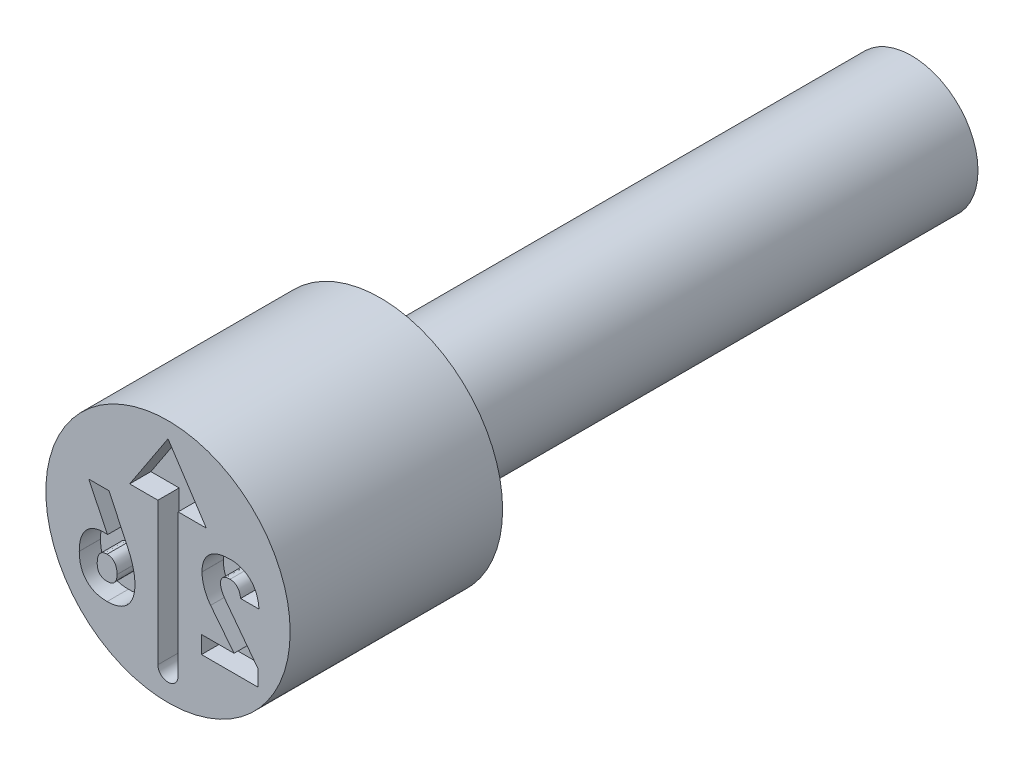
SolidWorks part; units mm, degrees
ref_plane "Front Plane" through (0, 0, 0) normal (0, 0, 1) x (1, 0, 0)
ref_plane "Top Plane" through (0, 0, 0) normal (0, 1, 0) x (1, 0, 0)
ref_plane "Right Plane" through (0, 0, 0) normal (1, 0, 0) x (0, 0, -1)
sketch "Sketch2" plane through (0, 0, 0) normal (1, 0, 0) x (0, 0, -1)
  line L0 (0.4039, 0) -> (50000.4039, 0) construction
  line L6 (0, 2.3) -> (0, 0)
  line L7 (4, 2.3) -> (0, 2.3)
  line L8 (4, 1.25) -> (4, 2.3)
  line L9 (14, 1.25) -> (4, 1.25)
  line L10 (14, 0) -> (14, 1.25)
  line L11 (0, 0) -> (14, 0)
  dimension "D1" = 4.6
  dimension "D2" = 2.5
  dimension "D3" = 14
  dimension "D4" = 4
revolve "Revolve1" add sketch "Sketch2" angle 360 about L0
sketch "Sketch3" plane through (0, 0, 0) normal (0, 0, 1) x (1, 0, 0)
  line L0 (0, 0) -> (0, 100000) construction
  line L1 (0.1905, 0.9064) -> (0.1905, -1.7762)
  line L2 (0.7219, 0.9064) -> (0.1905, 0.9064)
  line L3 (0, 2.0021) -> (0.7219, 0.9064)
  line L15 (0, 2.0021) -> (-0.7219, 0.9064)
  line L16 (-0.7219, 0.9064) -> (-0.1905, 0.9064)
  line L17 (-0.1905, 0.9064) -> (-0.1905, -1.7762)
  arc A2 (-0.1905, -1.7762) -> (0.1905, -1.7762) centre (0, -1.7762) ccw
extrude "Cut-Extrude4" cut sketch "Sketch3" against normal blind 0.4
sketch "Sketch4" plane through (0, 0, 0) normal (0, 0, 1) x (1, 0, 0)
  text T0 "2  6" font "Bahnschrift" height 1.8
  dimension "D1" = 1.2
extrude "Cut-Extrude5" cut sketch "Sketch4" against normal blind 0.4
